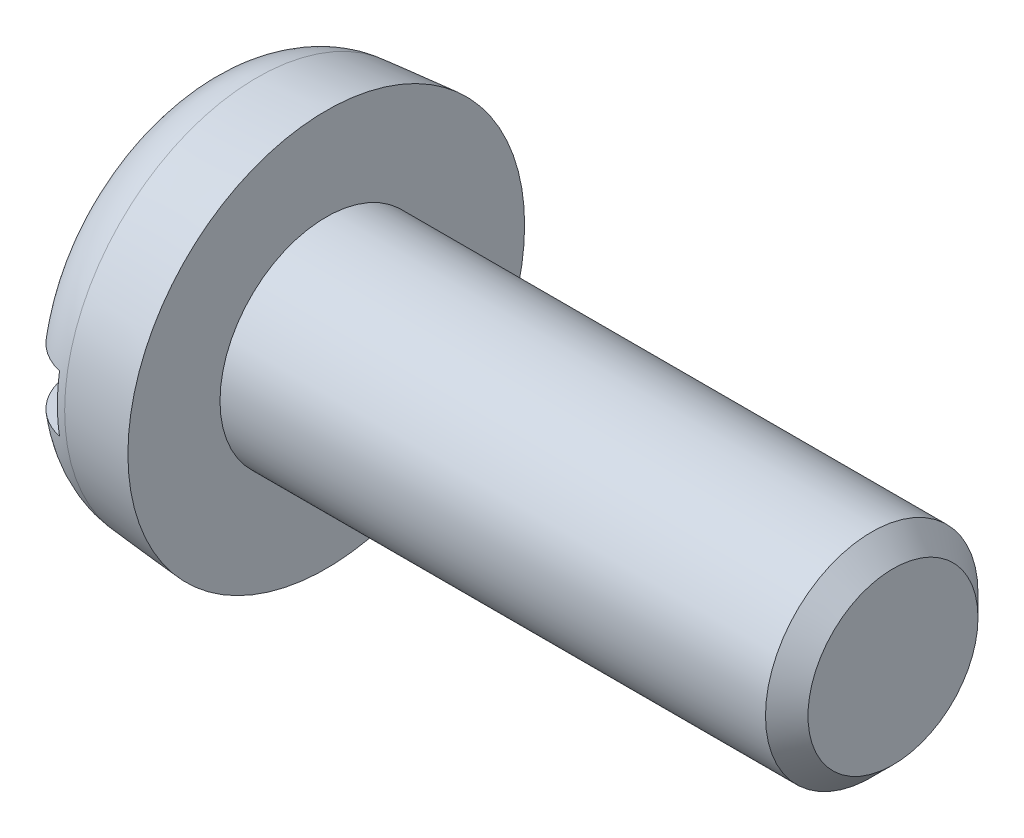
SolidWorks part; units mm, degrees
ref_plane "Plane1" through (0, 0, 0) normal (0, 0, 1) x (1, 0, 0)
ref_plane "Plane2" through (0, 0, 0) normal (0, 1, 0) x (1, 0, 0)
ref_plane "Plane3" through (0, 0, 0) normal (1, 0, 0) x (0, 0, -1)
revolve "Base-Revolve" add sketch "BodySke"
sketch "BodySke" plane through (0, 0, 0) normal (0, 0, 1) x (1, 0, 0)
  line L0 (1.8, 1.5) -> (1.8, 2.8)
  line L1 (0, 0) -> (0, 2.6425)
  line L2 (-25.4, 0) -> (127, 0) construction
  line L3 (9.8, 0) -> (0, 0)
  line L4 (1.8, 1.5) -> (9.8, 1.5)
  line L5 (9.8, 1.5) -> (9.8, 0)
  line L6 (0, 2.6425) -> (1.8, 2.8)
  line L9 (2.3, 3.0875) -> (2.3, -6.4375) construction
  line L10 (1.8, 6.35) -> (1.8, -3.175) construction
  dimension "Head_ht" = 1.8
  dimension "Diameter" = 3
  dimension "Length" = 8
  dimension "Head_dia" = 5.6
  dimension "Advance" = 0.5
  dimension "Thread_nom" = 8
  dimension "Head_side_angle" = 5
fillet "Fillet1" radius 0.1
fillet "Fillet2" radius 0.9 1 edges at (0, 0, 2.6425)
sketch "Sketch2" plane through (0, 0, 0) normal (1, 0, 0) x (0, 0, -1)
  line L0 (2.8, -0.4) -> (-2.8, -0.4)
  line L1 (2.8, -0.4) -> (2.8, 0.4)
  line L2 (-2.8, 0.4) -> (2.8, 0.4)
  line L3 (-2.8, 0.4) -> (-2.8, -0.4)
  dimension "D1" = 5.6
  dimension "D2" = 2.8
  dimension "Slot_width" = 0.8
  dimension "D3" = 0.4
extrude "Slot" cut sketch "Sketch2" along normal blind 0.7
sketch "ThdSchSke" plane through (0, 0, 0) normal (0, 0, 1) x (1, 0, 0)
  line L0 (2.8, -1.2195) -> (2.6036, -1.5)
  line L1 (2.8, -1.2195) -> (2.9964, -1.5)
  line L2 (2.9964, -1.5) -> (2.9964, -1.875)
  line L3 (-3.175, 0) -> (5.1513, 0) construction
  line L5 (2.9964, -1.875) -> (2.6036, -1.875)
  line L6 (2.6036, -1.875) -> (2.6036, -1.5)
  dimension "Thread_minor" = 2.439
  dimension "Diameter" = 3
  dimension "Start" = 2.8
  dimension "SideAngle" = 55
  dimension "VeeAngle" = 70
  dimension "Overcut" = 3.75
revolve "ThreadSchematic" cut sketch "ThdSchSke" angle 360 about L3
pattern_linear "ThdSchPat"
chamfer "Chanfrein1" distance 0.3 angle 45 1 edges at (9.8, 0, 1.5)
equation "\"D1@Sketch2\" = \"Head_dia@BodySke\""
equation "\"D2@Sketch2\" = \"D1@Sketch2\" / 2"
equation "\"D3@Sketch2\" = \"Slot_width@Sketch2\" / 2"
equation "\"Thread_length@ThreadCosmetic\" = ((sgn( (\"Length@BodySke\" - \"Advance@BodySke\" * 2.0 ) - \"Thread_nom@BodySke\" )-1)*( (\"Length@BodySke\" - \"Advance@BodySke\"  * 2.0) - \"Thread_nom@BodySke\" ))/-2+ \"Thread_"
equation "\"Thread_minor@ThdSchSke\" = \"Thread_minor@ThreadCosmetic\""
equation "\"Diameter@ThdSchSke\" = \"Diameter@BodySke\""
equation "\"Overcut@ThdSchSke\" = \"Diameter@BodySke\" * 1.25"
equation "\"Start@ThdSchSke\" = \"Head_ht@BodySke\" + \"Length@BodySke\" - \"Thread_length@ThreadCosmetic\"  '---Non-countersunk---"
equation "\"Num_threads@ThdSchPat\" = int( \"Thread_length@ThreadCosmetic\" / \"Advance@BodySke\" + 0.999 )  + 1"
equation "\"Advance@ThdSchPat\" = \"Thread_length@ThreadCosmetic\" /  (\"Num_threads@ThdSchPat\" - 1) 'relax it"
